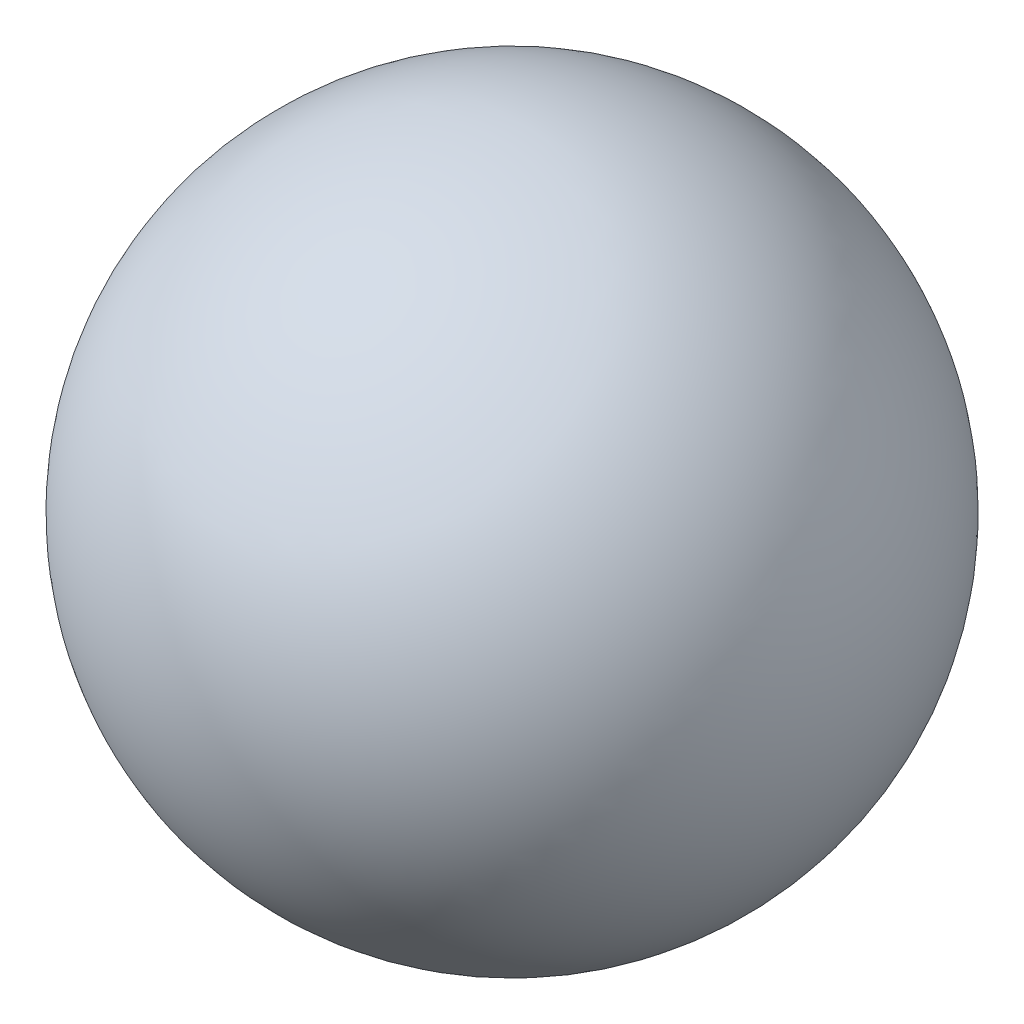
SolidWorks part; units mm, degrees
ref_plane "Ebene vorne" through (0, 0, 0) normal (0, 0, 1) x (1, 0, 0)
ref_plane "Ebene oben" through (0, 0, 0) normal (0, 1, 0) x (1, 0, 0)
ref_plane "Ebene rechts" through (0, 0, 0) normal (1, 0, 0) x (0, 0, -1)
sketch "Skizze2" plane through (0, 0, 0) normal (0, 1, 0) x (1, 0, 0)
  line L0 (0, 0) -> (0, 23.4463) construction
  line L1 (0, 10) -> (0, -10)
  arc A0 (0, 10) -> (0, -10) centre (0, 0) ccw
  dimension "D1" = 10
revolve "Rotation2" add sketch "Skizze2" angle 360 about L0
